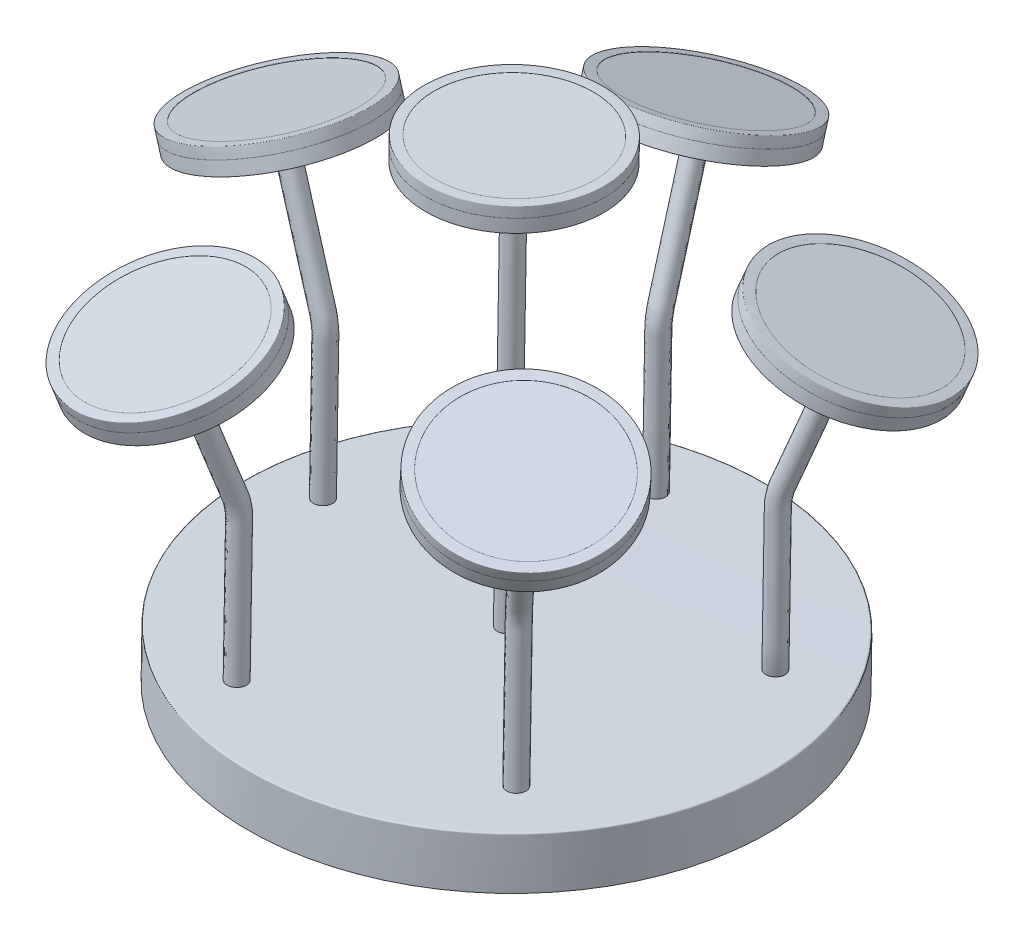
SolidWorks part; units mm, degrees
ref_plane "Alzado" through (0, 0, 0) normal (0, 0, 1) x (1, 0, 0)
ref_plane "Planta" through (0, 0, 0) normal (0, 1, 0) x (1, 0, 0)
ref_plane "Vista lateral" through (0, 0, 0) normal (1, 0, 0) x (0, 0, -1)
other "Gráfico1"
imported_body "Sólido importado1"
imported_body "Sólido importado2"
imported_body "Sólido importado3"
imported_body "Sólido importado4"
imported_body "Sólido importado5"
imported_body "Sólido importado6"
imported_body "Sólido importado7"
imported_body "Sólido importado8"
imported_body "Sólido importado9"
imported_body "Sólido importado10"
imported_body "Sólido importado11"
imported_body "Sólido importado12"
imported_body "Sólido importado13"
imported_body "Sólido importado14"
imported_body "Sólido importado15"
imported_body "Sólido importado16"
imported_body "Sólido importado17"
imported_body "Sólido importado18"
imported_body "Sólido importado19"
imported_body "Sólido importado20"
imported_body "Sólido importado21"
imported_body "Sólido importado22"
imported_body "Sólido importado23"
imported_body "Sólido importado24"
imported_body "Sólido importado25"
move or copy body "Sólido-Mover/Copiar1" bodies to move or copy 101 125 103 104 102 106 105 112 116 123 111 115 114 110 121 109 113 117 118 107 108 119 120 124 122 copy no rotation origin (0, 0.185, 221.4021) rotation axis (1, 0, 0) rotation angle 89
